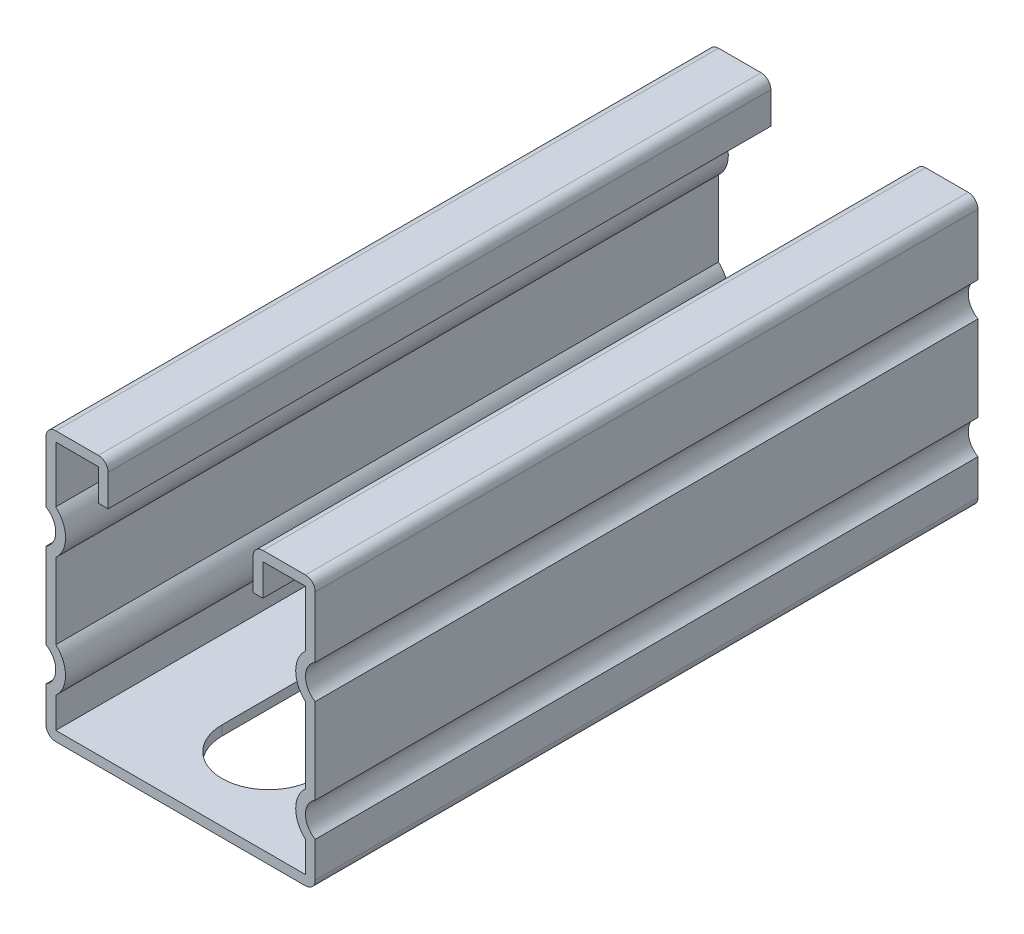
SolidWorks part; units mm, degrees
ref_plane "Plane1" through (0, 0, 0) normal (0, 0, 1) x (1, 0, 0)
ref_plane "Plane2" through (0, 0, 0) normal (0, 1, 0) x (1, 0, 0)
ref_plane "Plane3" through (0, 0, 0) normal (1, 0, 0) x (0, 0, -1)
sketch "Sketch1" plane through (0, 0, 0) normal (0, 0, 1) x (1, 0, 0)
  line L0 (-20.6375, 21.1074) -> (-20.6375, 11.7397)
  line L1 (-20.6375, 6.5483) -> (-20.6375, -6.5483)
  line L2 (-19.1389, -18.669) -> (19.1389, -18.669)
  line L3 (20.6375, -17.1704) -> (20.6375, -11.7397)
  line L4 (20.6375, 11.7397) -> (20.6375, 21.1074)
  line L5 (19.1389, 22.606) -> (12.6111, 22.606)
  line L6 (11.1125, 21.1074) -> (11.1125, 16.256)
  line L7 (-19.1389, 22.606) -> (-12.6111, 22.606)
  line L8 (-11.1125, 21.1074) -> (-11.1125, 16.256)
  line L9 (19.1389, -12.495) -> (19.1389, 12.495) construction
  line L10 (-19.1389, 12.495) -> (-19.1389, -12.495) construction
  line L11 (-12.6111, 21.1074) -> (-12.6111, 16.256)
  line L12 (-19.1389, 21.1074) -> (-12.6111, 21.1074)
  line L13 (-19.1389, 21.1074) -> (-19.1389, 12.495)
  line L14 (-19.1389, 5.793) -> (-19.1389, -5.793)
  line L15 (-19.1389, -17.1704) -> (19.1389, -17.1704)
  line L16 (19.1389, -17.1704) -> (19.1389, -12.495)
  line L17 (19.1389, 12.495) -> (19.1389, 21.1074)
  line L18 (19.1389, 21.1074) -> (12.6111, 21.1074)
  line L19 (12.6111, 21.1074) -> (12.6111, 16.256)
  line L20 (-12.6111, 16.256) -> (-11.1125, 16.256)
  line L21 (11.1125, 16.256) -> (12.6111, 16.256)
  line L22 (-10.16, 0) -> (12.7, 0) construction
  line L23 (-20.6375, -11.7397) -> (-20.6375, -17.1704)
  line L24 (-19.1389, -12.495) -> (-19.1389, -17.1704)
  line L25 (20.6375, -6.5483) -> (20.6375, 6.5483)
  line L26 (19.1389, -5.793) -> (19.1389, 5.793)
  arc A0 (20.6375, 11.7397) -> (20.6375, 6.5483) centre (22.1361, 9.144) ccw
  arc A1 (-20.6375, 6.5483) -> (-20.6375, 11.7397) centre (-22.1361, 9.144) ccw
  arc A2 (-12.6111, 22.606) -> (-11.1125, 21.1074) centre (-12.6111, 21.1074) cw
  arc A3 (-20.6375, 21.1074) -> (-19.1389, 22.606) centre (-19.1389, 21.1074) cw
  arc A4 (-19.1389, -18.669) -> (-20.6375, -17.1704) centre (-19.1389, -17.1704) cw
  arc A5 (20.6375, -17.1704) -> (19.1389, -18.669) centre (19.1389, -17.1704) cw
  arc A6 (19.1389, 22.606) -> (20.6375, 21.1074) centre (19.1389, 21.1074) cw
  arc A7 (11.1125, 21.1074) -> (12.6111, 22.606) centre (12.6111, 21.1074) cw
  arc A8 (-19.1389, 5.793) -> (-19.1389, 12.495) centre (-22.1361, 9.144) ccw
  arc A9 (19.1389, 12.495) -> (19.1389, 5.793) centre (22.1361, 9.144) ccw
  arc A10 (20.6375, -11.7397) -> (20.6375, -6.5483) centre (22.1361, -9.144) cw
  arc A11 (19.1389, -12.495) -> (19.1389, -5.793) centre (22.1361, -9.144) cw
  arc A12 (-19.1389, -5.793) -> (-19.1389, -12.495) centre (-22.1361, -9.144) cw
  arc A13 (-20.6375, -6.5483) -> (-20.6375, -11.7397) centre (-22.1361, -9.144) cw
  dimension "D1" = 20.6375
  dimension "D9" = 2.9972
  dimension "D10" = 2.9972
  dimension "D2" = 9.525
  dimension "Width" = 41.275
  dimension "base" = 18.669
  dimension "ToeHt" = 22.606
  dimension "D6" = 22.225
  dimension "edge" = 9.525
  dimension "Lip" = 6.35
  dimension "gauge" = 1.4986
extrude "Base-Extrude" add sketch "Sketch1" along normal blind 101.6
extrude "Slot" cut sketch "Sketch2" against normal through all
sketch "Sketch2" plane through (1.1214, -18.669, -18.7802) normal (0, -1, 0) x (1, 0, 0)
  line L0 (6.0223, 56.0864) -> (6.0223, 41.7989)
  line L1 (-8.2652, 41.7989) -> (-8.2652, 56.0864)
  arc A0 (-8.2652, 41.7989) -> (6.0223, 41.7989) centre (-1.1214, 41.7989) ccw
  arc A1 (6.0223, 56.0864) -> (-8.2652, 56.0864) centre (-1.1214, 56.0864) ccw
  dimension "D3" = 14.2875
  dimension "D1" = 23.0188
  dimension "D2" = 14.2875
pattern_linear "LPattern1" count 2 spacing 50.8 along (0, 0, 1) of "Slot"
equation "\"D1@Sketch1\" = \"Width@Sketch1\" / 2"
equation "\"D6@Sketch1\" = \"Width@Sketch1\" - 2 * \"edge@Sketch1\""
equation "\"D10@Sketch1\" = 2 * \"gauge@Sketch1\""
equation "\"D9@Sketch1\" = \"D10@Sketch1\""
equation "\"D2@Sketch1\" = \"edge@Sketch1\""
equation "\"D1@LPattern1\" = \"D1@Base-Extrude\" / \"D3@LPattern1\""
